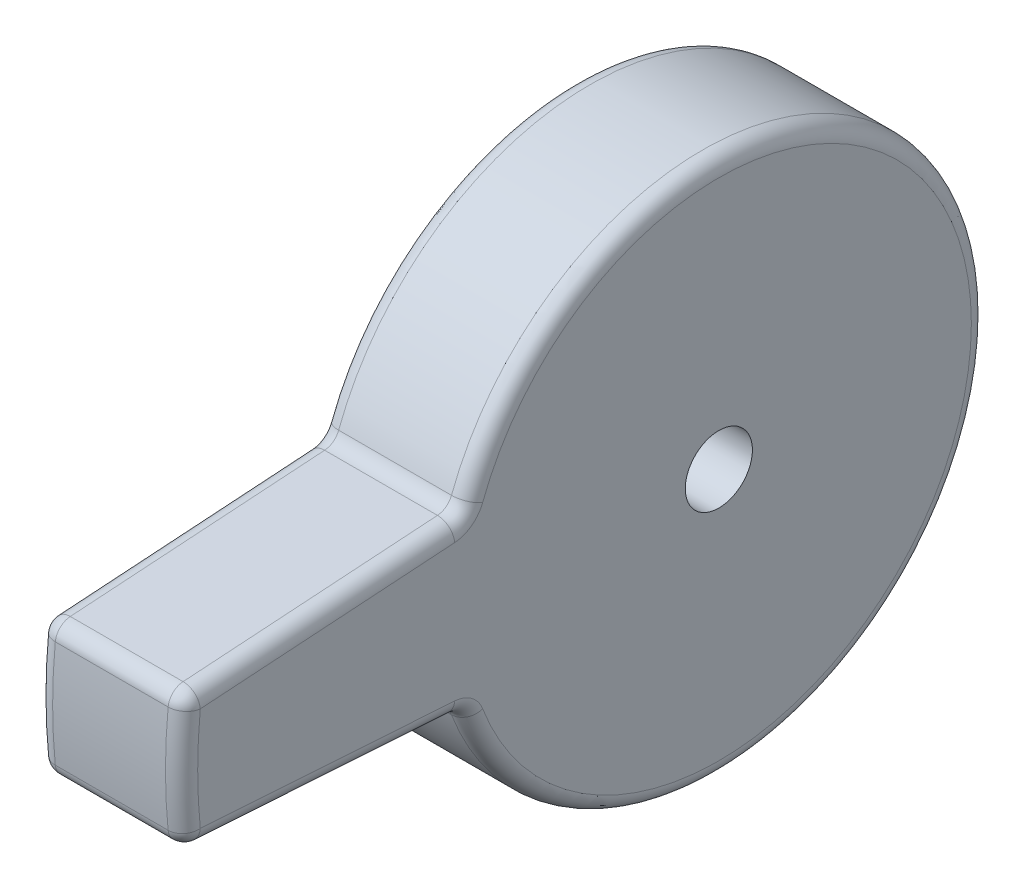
SolidWorks part; units mm, degrees
ref_plane "Front Plane" through (0, 0, 0) normal (0, 0, 1) x (1, 0, 0)
ref_plane "Top Plane" through (0, 0, 0) normal (0, 1, 0) x (1, 0, 0)
ref_plane "Right Plane" through (0, 0, 0) normal (1, 0, 0) x (0, 0, -1)
sketch "Sketch12" plane through (0, 0, 0) normal (1, 0, 0) x (0, 0, -1)
  line L0 (0, 0) -> (-25.4, 0) construction
  line L1 (-25.2018, 3.1667) -> (-12.0419, 4.0351)
  line L2 (0, 4.8296) -> (0, 0) construction
  line L3 (0, 0) -> (0, -4.8296) construction
  line L4 (-12.0419, -4.0351) -> (-25.2018, -3.1667)
  line L5 (-12.0419, -4.0351) -> (0, -4.8296) construction
  line L6 (0, 4.8296) -> (-12.0419, 4.0351) construction
  arc A0 (-12.0419, -4.0351) -> (-12.0419, 4.0351) centre (0, 0) ccw
  arc A1 (-25.2018, 3.1667) -> (-25.4, 0) centre (0, 0) ccw
  arc A2 (-25.4, 0) -> (-25.2018, -3.1667) centre (0, 0) ccw
  circle A3 centre (0, 0) radius 1.5875
  dimension "D1" = 25.4
  dimension "D2" = 3.175
  dimension "D3" = 3.175
extrude "Extrude11" add sketch "Sketch12" along normal mid plane 6.858
fillet "Fillet1" radius 0.762 12 edges at (0, 3.1667, 25.2018) (3.429, 0, 25.4) (0, -3.1667, 25.2018) (-3.429, 0, 25.4) (3.429, -3.6009, 18.6219) (-3.429, -3.6009, 18.6219) (-3.429, 3.6009, 18.6219) (3.429, 3.6009, 18.6219) (0, -4.0351, 12.0419) (0, 4.0351, 12.0419) (3.429, 0, -12.7) (-3.429, 0, -12.7)
equation "\"D3@Sketch12\"=\"D2@Sketch12\""
